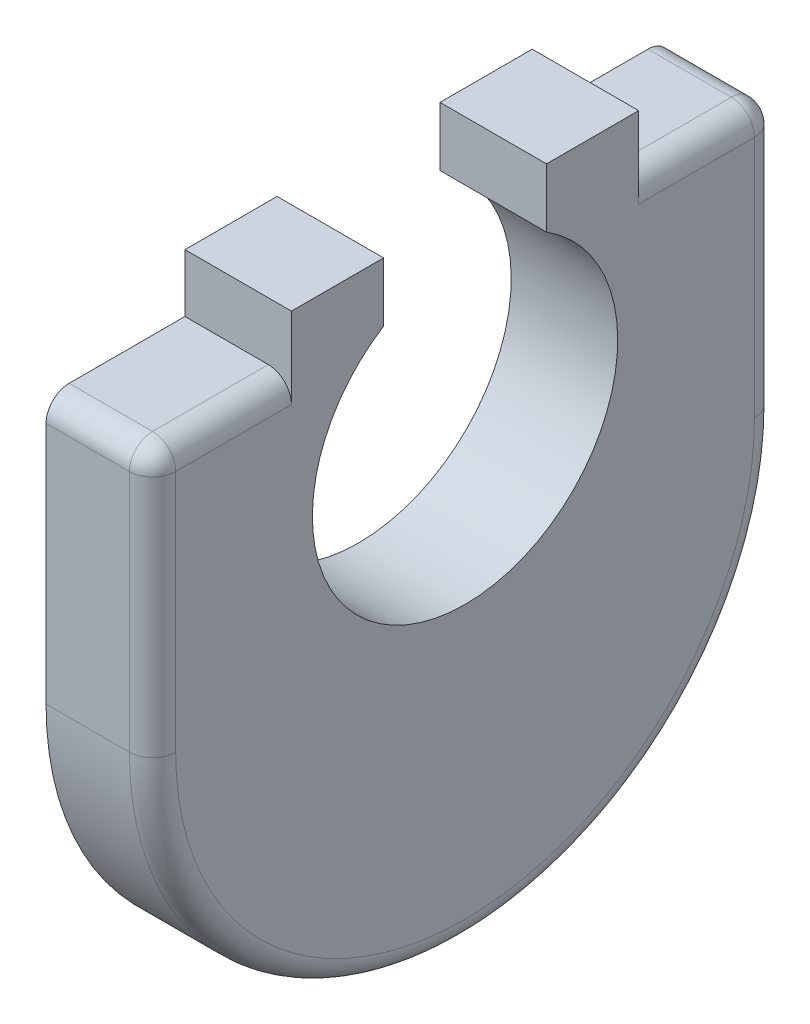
SolidWorks part; units mm, degrees
ref_plane "Front Plane" through (0, 0, 0) normal (0, 0, 1) x (1, 0, 0)
ref_plane "Top Plane" through (0, 0, 0) normal (0, 1, 0) x (1, 0, 0)
ref_plane "Right Plane" through (0, 0, 0) normal (1, 0, 0) x (0, 0, -1)
sketch "Sketch1" plane through (0, 0, 0) normal (1, 0, 0) x (0, 0, -1)
  line L0 (-17.145, 0) -> (-17.145, 14.605)
  line L1 (-17.145, 14.605) -> (-9.525, 14.605)
  line L2 (17.145, 14.605) -> (17.145, 0)
  line L3 (0, -17.145) -> (0, 34.122) construction
  line L5 (-9.525, 14.605) -> (-9.525, 17.78)
  line L6 (-9.525, 17.78) -> (9.525, 17.78)
  line L7 (9.525, 14.605) -> (9.525, 17.78)
  line L8 (9.525, 14.605) -> (17.145, 14.605)
  arc A0 (-17.145, 0) -> (17.145, 0) centre (0, 0) ccw
  point P1 (0, -17.145)
  dimension "D1" = 34.29
  dimension "D2" = 31.75
  dimension "D3" = 7.62
  dimension "D4" = 7.62
  dimension "D5" = 3.175
extrude "Boss-Extrude1" add sketch "Sketch1" along normal mid plane 5.842
fillet "Fillet1" radius 1.27 7 edges at (2.921, 7.3025, -17.145) (2.921, -17.145, 0) (2.921, 14.605, -13.335) (2.921, 14.605, 13.335) (0, 14.605, -17.145) (0, 14.605, 17.145) (2.921, 7.3025, 17.145)
ref_plane "Plane1" through (2.921, 0, 0) normal (1, 0, 0) x (0, 0, -1)
sketch "Sketch2" plane through (2.921, 0, 0) normal (1, 0, 0) x (0, 0, -1)
  line L2 (4.4685, 17.78) -> (-4.4685, 17.78)
  line L4 (9.5485, 13.335) -> (9.5015, 13.335)
  line L9 (4.4685, 17.78) -> (-4.4685, 17.78)
  line L11 (9.5485, 13.335) -> (9.5015, 13.335)
  line L14 (-4.4685, 17.78) -> (-4.4685, 14.5386)
  line L15 (0, 0) -> (0, 7.4545) construction
  line L16 (4.4685, 17.78) -> (4.4685, 14.5386)
  line L21 (-4.4685, 17.78) -> (4.4685, 17.78)
  line L28 (-4.4685, 17.78) -> (4.4685, 17.78)
  line L31 (-9.5015, 17.78) -> (-9.5485, 17.78)
  line L32 (-9.5015, 17.78) -> (-9.5485, 17.78)
  line L33 (9.5015, 17.78) -> (9.5485, 17.78)
  line L34 (9.5015, 17.78) -> (9.5485, 17.78)
  arc A2 (-4.4685, 14.5386) -> (4.4685, 14.5386) centre (0, 7.4545) ccw
  arc A3 (-15.875, 0) -> (15.875, 0) centre (0, 0) ccw construction
  point P12 (0, -15.875)
  point P13 (0, -15.875)
extrude "Cut-Extrude2" cut sketch "Sketch2" against normal through all
ref_plane "Plane2" through (-2.921, 0, 0) normal (-1, 0, 0) x (0, 0, 1)
sketch "Sketch3" plane through (-2.921, 0, 0) normal (-1, 0, 0) x (0, 0, 1)
  line L5 (-10.2851, 11.811) -> (-14.351, 11.811)
  line L6 (-14.351, 11.811) -> (-14.351, 0)
  line L7 (14.351, 0) -> (14.351, 11.811)
  line L8 (14.351, 11.811) -> (10.2851, 11.811)
  arc A0 (-10.2851, 11.811) -> (10.2851, 11.811) centre (0, 7.4545) ccw
  arc A2 (-14.351, 0) -> (14.351, 0) centre (0, 0) ccw
extrude "Cut-Extrude3" cut sketch "Sketch3" against normal blind 2.794
